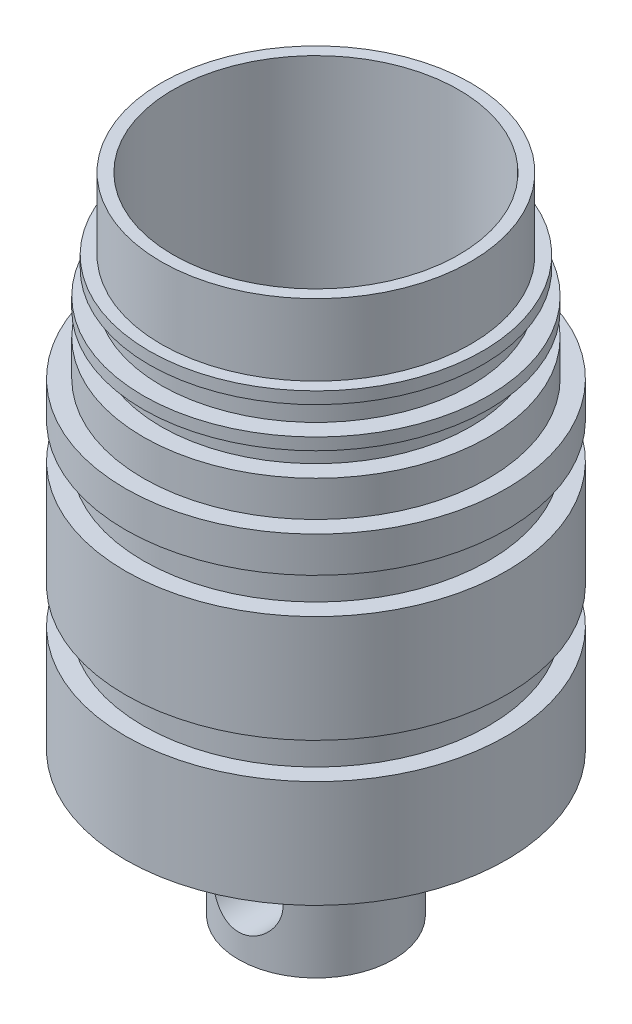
SolidWorks part; units mm, degrees
ref_plane "Face" through (0, 0, 0) normal (0, 0, 1) x (1, 0, 0)
ref_plane "Dessus" through (0, 0, 0) normal (0, 1, 0) x (1, 0, 0)
ref_plane "Droite" through (0, 0, 0) normal (1, 0, 0) x (0, 0, -1)
sketch "Esquisse1" plane through (0, 0, 0) normal (1, 0, 0) x (0, 0, -1)
  line L0 (0, 26.4066) -> (0, -18.4427) construction
  line L1 (6, 20.5) -> (6, 0)
  line L2 (6, 0) -> (0, -2)
  line L3 (0, -2) -> (0, -6.5)
  line L4 (0, -6.5) -> (3.25, -6.5)
  line L5 (3.25, -6.5) -> (3.25, -2.0833)
  line L6 (3.25, -2.0833) -> (8, -0.5)
  line L7 (8, -0.5) -> (8, 4)
  line L8 (8, 4) -> (7.25, 4)
  line L9 (7.25, 4) -> (7.25, 5.5)
  line L10 (7.25, 5.5) -> (8, 5.5)
  line L11 (8, 5.5) -> (8, 10)
  line L12 (8, 10) -> (7.25, 10)
  line L13 (7.25, 10) -> (7.25, 11.5)
  line L14 (7.25, 11.5) -> (8, 11.5)
  line L15 (8, 11.5) -> (8, 13)
  line L16 (8, 13) -> (7.25, 13)
  line L17 (7.25, 13) -> (7.25, 14.5)
  line L18 (7.25, 14.5) -> (6.5, 14.5)
  line L19 (6.5, 14.5) -> (6.5, 15.5)
  line L20 (6.5, 15.5) -> (7.25, 15.5)
  line L21 (7.25, 15.5) -> (7.25, 16)
  line L22 (7.25, 16) -> (6.5, 16)
  line L23 (6.5, 16) -> (6.5, 17)
  line L24 (6.5, 17) -> (7, 17)
  line L25 (7, 17) -> (7, 17.5)
  line L26 (6.5, 20.5) -> (6, 20.5)
  line L27 (7, 17.5) -> (6.5, 17.5)
  line L28 (6.5, 17.5) -> (6.5, 20.5)
  dimension "D1" = 6
  dimension "D2" = 6.5
  dimension "D3" = 6.5
  dimension "D4" = 1
  dimension "D5" = 1
  dimension "D6" = 0.5
  dimension "D7" = 5
  dimension "D8" = 20.5
  dimension "D9" = 7.25
  dimension "D10" = 8
  dimension "D11" = 1.5
  dimension "D12" = 4.5
  dimension "D13" = 1.5
  dimension "D14" = 1.5
  dimension "D15" = 1.5
  dimension "D16" = 4.5
  dimension "D17" = 22.5
  dimension "D18" = 3.25
  dimension "D19" = 27
  dimension "D20" = 0.5
  dimension "D21" = 7
revolve "Révolution1" add sketch "Esquisse1" angle 360 about L0
sketch "Esquisse2" plane through (0, 0, 0) normal (0, 0, 1) x (1, 0, 0)
  circle A0 centre (0, -4) radius 1.5
  dimension "D1" = 3
  dimension "D2" = 4
extrude "Enlèv. mat.-Extru.1" cut sketch "Esquisse2" against normal mid plane 10
